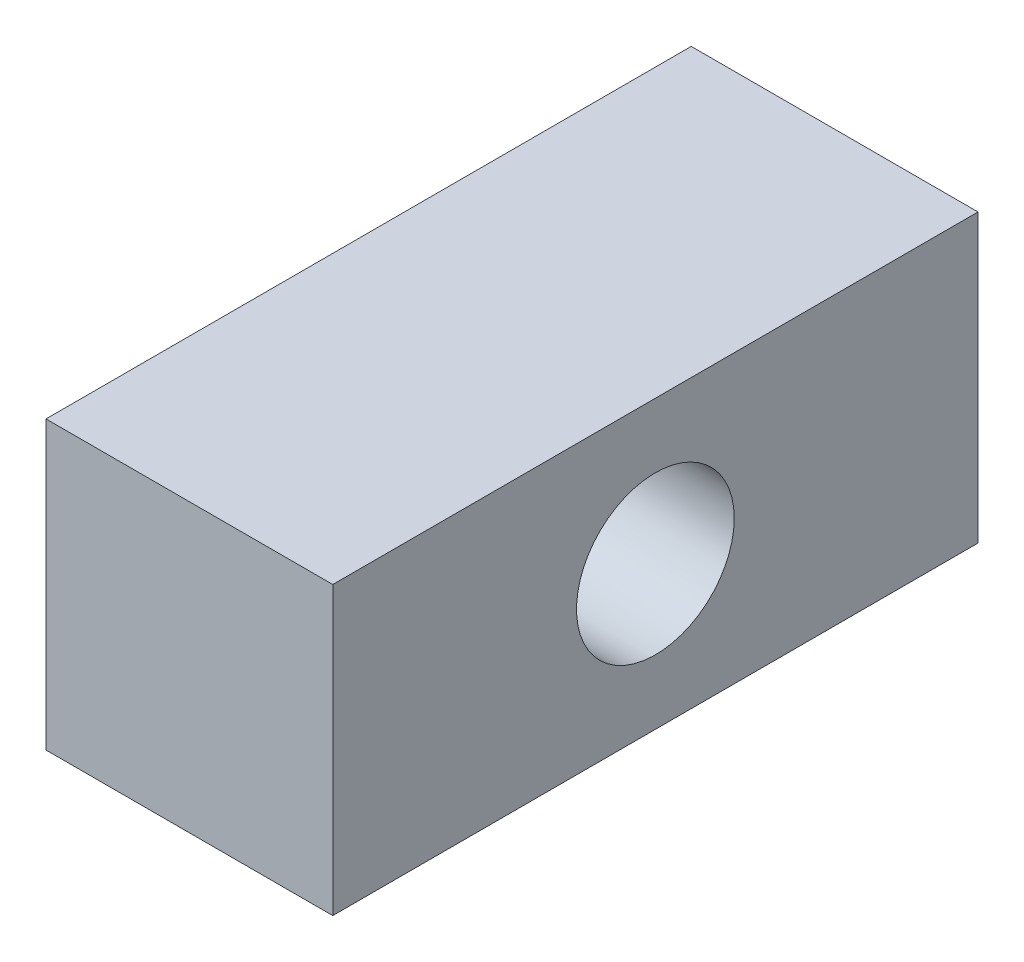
SolidWorks part; units mm, degrees
ref_plane "Plan de face" through (0, 0, 0) normal (0, 0, 1) x (1, 0, 0)
ref_plane "Plan de dessus" through (0, 0, 0) normal (0, 1, 0) x (1, 0, 0)
ref_plane "Plan de droite" through (0, 0, 0) normal (1, 0, 0) x (0, 0, -1)
sketch "Esquisse1" plane through (0, 0, 0) normal (0, 0, 1) x (1, 0, 0)
  line L0 (-60, -58.5) -> (60, -58.5) construction
  line L1 (30, -58.5) -> (70, -58.5)
  line L2 (30, -58.5) -> (30, -18.5)
  line L3 (30, -18.5) -> (70, -18.5)
  line L4 (70, -58.5) -> (70, -18.5)
  line L6 (60, -1316.5) -> (60, 1316.5) construction
  dimension "D1" = 40
  dimension "D2" = 40
  dimension "D3" = 10
extrude "Boss.-Extru.3" add sketch "Esquisse1" along normal up to surface (90 mm away)
hole_wizard "Dégagement M201" positions "Esquisse3" profile "Esquisse2" hole size "M20" standard "ISO"
sketch "Esquisse3" plane through (70, -86.2423, 21.5388) normal (-1, 0, 0) x (0, -1, 0)
  line L2 (-67.7423, -21.5388) -> (-27.7423, 68.4612) construction
  line L3 (-27.7423, 68.4612) -> (-27.7423, -21.5388) construction
  line L4 (-67.7423, 68.4612) -> (-27.7423, -21.5388) construction
  point P0 (-47.7423, 23.4612)
sketch "Esquisse2" plane through (70, -38.5, 45) normal (0, 1, 0) x (0, 0, -1)
  line L0 (0, 0) -> (0, 40)
  line L1 (0, 40) -> (11, 40)
  line L2 (11, 40) -> (11, 0)
  line L5 (11, 0) -> (0, 0)
  line L11 (0, -6.35) -> (0, 107.95) construction
  dimension "Diamètre du perçage jusqu'au prochain" = 22
  dimension "Profondeur du perçage jusqu'au prochain" = 40
